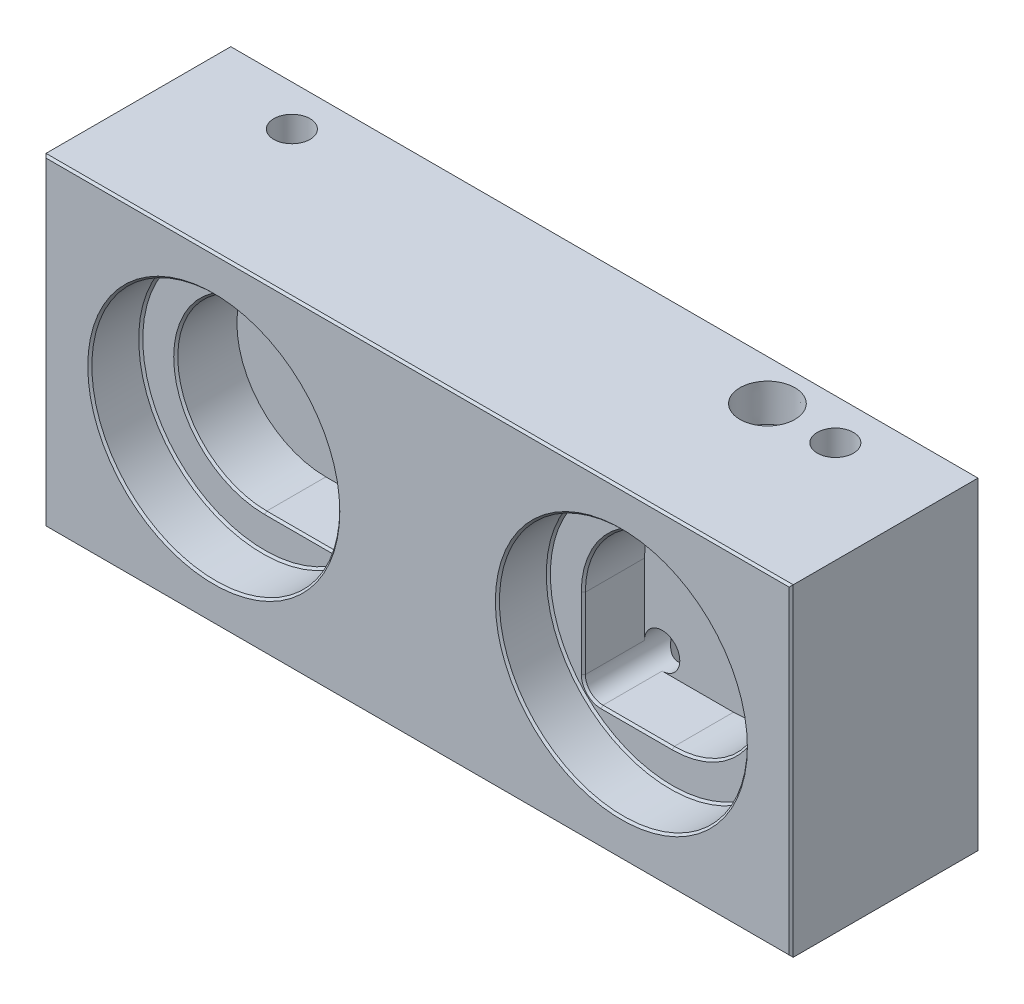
SolidWorks part; units mm, degrees
ref_plane "Front Plane" through (0, 0, 0) normal (0, 0, 1) x (1, 0, 0)
ref_plane "Top Plane" through (0, 0, 0) normal (0, 1, 0) x (1, 0, 0)
ref_plane "Right Plane" through (0, 0, 0) normal (1, 0, 0) x (0, 0, -1)
sketch "Sketch1" plane through (0, 0, 0) normal (0, 0, 1) x (1, 0, 0)
  line L1 (0, 0) -> (139.7, 0)
  line L2 (0, 0) -> (0, 60.325)
  line L3 (0, 60.325) -> (139.7, 60.325)
  line L4 (139.7, 0) -> (139.7, 60.325)
  dimension "D1" = 60.325
  dimension "D2" = 139.7
extrude "BAR STOCK" add sketch "Sketch1" along normal blind 34.925
sketch "Sketch3" plane through (0, 0, 34.925) normal (0, 0, 1) x (1, 0, 0)
  line L0 (69.85, 60.325) -> (69.85, -16.0681) construction
  line L1 (139.7, 60.325) -> (0, 60.325) construction
  line L2 (0, 30.1625) -> (211.9405, 30.1625) construction
  line L3 (0, 60.325) -> (0, 0) construction
  circle A0 centre (31.75, 30.1625) radius 23.1775
  circle A1 centre (107.95, 30.1625) radius 23.1775
  dimension "D1" = 46.355
  dimension "D3" = 46.355
  dimension "D2" = 38.1
  dimension "D4" = 38.1
extrude "pump holes" cut sketch "Sketch3" against normal blind 9.525
sketch "Sketch4" plane through (0, 0, 25.4) normal (0, 0, 1) x (1, 0, 0)
  line L0 (31.75, 13.5255) -> (45.085, 13.5255)
  line L1 (48.387, 30.1625) -> (48.387, 16.8275)
  line L2 (91.313, 30.1625) -> (91.313, 16.8275)
  line L3 (107.95, 13.5255) -> (94.615, 13.5255)
  arc A0 (48.387, 30.1625) -> (31.75, 13.5255) centre (31.75, 30.1625) ccw
  arc A1 (107.95, 13.5255) -> (91.313, 30.1625) centre (107.95, 30.1625) ccw
  arc A2 (91.313, 16.8275) -> (94.615, 13.5255) centre (94.615, 16.8275) ccw
  arc A3 (48.387, 16.8275) -> (45.085, 13.5255) centre (45.085, 16.8275) cw
  dimension "D1" = 33.274
  dimension "D2" = 33.274
  dimension "D3" = 3.302
extrude "pump volute" cut sketch "Sketch4" against normal blind 11.43
sketch "Sketch5" plane through (0, 0, 13.97) normal (0, 0, 1) x (1, 0, 0)
  circle A0 centre (31.75, 30.1625) radius 4.7625
  circle A1 centre (107.95, 30.1625) radius 4.7625
  circle A2 centre (94.615, 16.8275) radius 3.302
  circle A3 centre (45.085, 16.8275) radius 3.302
  point P11 (31.75, 30.1625)
  point P12 (107.95, 30.1625)
  dimension "D1" = 9.525
  dimension "D2" = 9.525
extrude "pump flow holes" cut sketch "Sketch5" against normal blind 6.35
sketch "Sketch6" plane through (0, 0, 0) normal (0, -1, 0) x (1, 0, 0)
  line L0 (-0.7642, 7.62) -> (112.7125, 7.62) construction
  line L2 (31.75, 7.62) -> (31.75, 25.3945) construction
  line L3 (36.5125, 7.62) -> (26.9875, 7.62) construction
  line L4 (45.085, 7.62) -> (45.085, 13.4169) construction
  line L5 (48.387, 7.62) -> (41.783, 7.62) construction
  line L6 (45.085, 13.97) -> (45.085, 25.4) construction
  circle A0 centre (31.75, 7.62) radius 3.3782
  dimension "D1" = 13.335
  dimension "D3" = 6.7564
extrude "stir inlet" cut sketch "Sketch6" against normal blind 34.925
sketch "Sketch7" plane through (0, 0, 0) normal (0, -1, 0) x (1, 0, 0)
  line L0 (31.75, 7.62) -> (121.5146, 7.62) construction
  line L1 (45.085, 7.62) -> (45.085, 9.7353) construction
  line L2 (48.387, 7.62) -> (41.783, 7.62) construction
  line L3 (94.615, 7.62) -> (94.615, 15.1152) construction
  line L4 (97.917, 7.62) -> (91.313, 7.62) construction
  circle A0 centre (45.085, 7.62) radius 3.3782
  circle A1 centre (94.615, 7.62) radius 3.3782
  dimension "D1" = 6.7564
  dimension "D2" = 6.7564
extrude "stir flush out" cut sketch "Sketch7" against normal blind 19.05
sketch "Sketch10" plane through (0, 0, 0) normal (0, -1, 0) x (1, 0, 0)
  line L0 (3.7298, 7.62) -> (135.9702, 7.62) construction
  line L1 (69.85, 0) -> (69.85, 30.8232) construction
  line L2 (0, 0) -> (139.7, 0) construction
  circle A1 centre (19.05, 7.62) radius 3.3782
  circle A2 centre (120.65, 7.62) radius 3.3782
  point P7 (0, 0)
  dimension "D1" = 6.7564
  dimension "D2" = 50.8
  dimension "D3" = 6.7564
  dimension "D4" = 50.8
extrude "mounting holes" cut sketch "Sketch10" against normal through all
sketch "Sketch11" plane through (0, 0, 34.925) normal (0, 0, 1) x (1, 0, 0)
  line L8 (0, 60.325) -> (0, 0)
  line L9 (0, 0) -> (139.7, 0)
  line L10 (139.7, 0) -> (139.7, 60.325)
  line L11 (139.7, 60.325) -> (0, 60.325)
  line L12 (0, 60.325) -> (0, 0)
  line L13 (0, 0) -> (139.7, 0)
  line L14 (139.7, 0) -> (139.7, 60.325)
  line L15 (139.7, 60.325) -> (0, 60.325)
  circle A6 centre (31.75, 30.1625) radius 25.7175
  circle A7 centre (31.75, 30.1625) radius 25.7175
  circle A9 centre (107.95, 30.1625) radius 25.7175
  circle A10 centre (107.95, 30.1625) radius 25.7175
  dimension "D1" = 2.54
  dimension "D2" = 2.54
  dimension "D3" = 0
extrude "weight relif 1" [suppressed] cut sketch "Sketch11" against normal blind 19.05
sketch "Sketch12" [suppressed] plane through (0, 0, 15.875) normal (0, 0, 1) x (1, 0, 0)
  line L0 (55.0226, 9.525) -> (84.6774, 9.525)
  line L1 (9.525, 16.3602) -> (9.525, 0)
  line L3 (69.85, 60.325) -> (69.85, 48.0842) construction
  line L4 (139.7, 60.325) -> (0, 60.325)
  line L5 (0, 60.325) -> (0, 0)
  line L6 (0, 0) -> (9.525, 0)
  line L9 (139.7, 60.325) -> (139.7, 0)
  line L10 (0, 0) -> (139.7, 0) construction
  line L11 (139.7, 0) -> (130.175, 0)
  line L12 (130.175, 16.3602) -> (130.175, 0)
  line L18 (139.7, 60.325) -> (0, 60.325) construction
  circle A0 centre (31.75, 30.1625) radius 25.7175 construction
  arc A1 (52.3745, 14.7995) -> (9.1276, 17.9307) centre (31.75, 30.1625) ccw
  circle A3 centre (107.95, 30.1625) radius 25.7175 construction
  arc A4 (130.5724, 17.9307) -> (87.3255, 14.7995) centre (107.95, 30.1625) ccw
  arc A5 (87.3255, 14.7995) -> (84.6774, 9.525) centre (84.6774, 12.827) cw
  arc A6 (55.0226, 9.525) -> (52.3745, 14.7995) centre (55.0226, 12.827) cw
  arc A8 (130.175, 16.3602) -> (130.5724, 17.9307) centre (133.477, 16.3602) cw
  arc A16 (9.1276, 17.9307) -> (9.525, 16.3602) centre (6.223, 16.3602) cw
  point P17 (47.0955, 9.525)
  point P31 (130.175, 16.0026)
  point P44 (9.525, 17.2227)
  dimension "D8" = 3.302
  dimension "D4" = 3.302
  dimension "D5" = 3.302
  dimension "D2" = 60.325
  dimension "D3" = 9.525
  dimension "D1" = 60.325
extrude "profile cut" [suppressed] cut sketch "Sketch12" against normal through all
ref_plane "Plane1" through (0, 60.325, 0) normal (0, 1, 0) x (1, 0, 0)
ref_plane "Plane3" through (0, 30.1625, 0) normal (0, 1, 0) x (1, 0, 0)
sketch "Sketch13" [suppressed] plane through (0, 0, 0) normal (0, 0, -1) x (-1, 0, 0)
  line L0 (-69.85, 0) -> (-69.85, 68.6634) construction
  line L1 (-84.6774, 9.525) -> (-85.471, 9.525)
  line L2 (-126.492, 0) -> (-126.492, 47.2214)
  line L3 (-13.97, 47.9834) -> (-38.8333, 47.9834)
  line L4 (-130.175, 16.3602) -> (-130.175, 0)
  line L5 (-130.175, 0) -> (-9.525, 0)
  line L6 (-9.525, 0) -> (-9.525, 16.3602)
  line L7 (-55.0226, 9.525) -> (-84.6774, 9.525)
  line L8 (-130.175, 16.3602) -> (-130.175, 0)
  line L9 (-88.773, 30.1625) -> (-88.773, 12.827)
  line L10 (-9.525, 0) -> (-130.175, 0) construction
  line L11 (-13.208, 0) -> (-9.525, 0)
  line L12 (-130.175, 16.3602) -> (-130.175, 0) construction
  line L13 (-125.73, 47.9834) -> (-100.8667, 47.9834)
  line L14 (-91.313, 30.1625) -> (-91.313, 16.8275) construction
  line L16 (-50.927, 30.1625) -> (-50.927, 12.827)
  line L17 (-9.525, 16.3602) -> (-9.525, 0)
  line L18 (-13.208, 0) -> (-13.208, 47.2214)
  line L19 (-55.0226, 9.525) -> (-54.229, 9.525)
  line L22 (-126.492, 0) -> (-130.175, 0)
  line L29 (-120.65, 2.9091) -> (-120.65, 55.6274) construction
  arc A0 (-88.773, 30.1625) -> (-100.8667, 47.9834) centre (-107.95, 30.1625) ccw
  arc A1 (-126.492, 47.9834) -> (-130.5724, 17.9307) centre (-107.95, 30.1625) ccw
  arc A2 (-85.471, 9.525) -> (-88.773, 12.827) centre (-85.471, 12.827) cw
  arc A3 (-125.73, 47.9834) -> (-126.492, 47.2214) centre (-125.73, 47.2214) ccw
  arc A5 (-9.525, 16.3602) -> (-9.1276, 17.9307) centre (-6.223, 16.3602) cw
  arc A6 (-9.1276, 17.9307) -> (-9.525, 16.3602) centre (-6.223, 16.3602) ccw
  arc A7 (-9.1276, 17.9307) -> (-52.3745, 14.7995) centre (-31.75, 30.1625) ccw
  arc A8 (-55.0226, 9.525) -> (-52.3745, 14.7995) centre (-55.0226, 12.827) ccw
  arc A9 (-87.3255, 14.7995) -> (-84.6774, 9.525) centre (-84.6774, 12.827) ccw
  arc A10 (-87.3255, 14.7995) -> (-130.5724, 17.9307) centre (-107.95, 30.1625) ccw
  arc A11 (-130.175, 16.3602) -> (-130.5724, 17.9307) centre (-133.477, 16.3602) ccw
  arc A12 (-52.3745, 14.7995) -> (-13.208, 47.9834) centre (-31.75, 30.1625) cw
  arc A13 (-52.3745, 14.7995) -> (-55.0226, 9.525) centre (-55.0226, 12.827) cw
  arc A15 (-87.3255, 14.7995) -> (-84.6774, 9.525) centre (-84.6774, 12.827) ccw
  arc A16 (-87.3255, 14.7995) -> (-126.492, 47.9834) centre (-107.95, 30.1625) ccw
  arc A17 (-130.175, 16.3602) -> (-130.5724, 17.9307) centre (-133.477, 16.3602) ccw
  arc A18 (-13.97, 47.9834) -> (-13.208, 47.2214) centre (-13.97, 47.2214) cw
  arc A19 (-54.229, 9.525) -> (-50.927, 12.827) centre (-54.229, 12.827) ccw
  arc A20 (-13.208, 47.9834) -> (-9.1276, 17.9307) centre (-31.75, 30.1625) cw
  arc A21 (-50.927, 30.1625) -> (-38.8333, 47.9834) centre (-31.75, 30.1625) cw
  dimension "D5" = 3.302
  dimension "D6" = 9.525
  dimension "D7" = 0.762
  dimension "D3" = 5.842
  dimension "D4" = 2.54
  dimension "D1" = 0
extrude "rear cut 1" [suppressed] cut sketch "Sketch13" against normal blind 22.86
sketch "Sketch14" plane through (0, 60.325, 0) normal (0, 1, 0) x (1, 0, 0)
  line L0 (107.95, -7.62) -> (107.95, 3.6647) construction
  line L1 (103.1875, -7.62) -> (112.7125, -7.62) construction
  circle A0 centre (107.95, -7.62) radius 3.81
  dimension "D1" = 7.62
extrude "flush inlet" cut sketch "Sketch14" against normal blind 22.86
sketch "Sketch15" plane through (0, 0, 0) normal (0, -1, 0) x (1, 0, 0)
  line L0 (47.5271, 7.62) -> (42.6429, 7.62) construction
  line L1 (97.0571, 7.62) -> (92.1729, 7.62) construction
  circle A0 centre (31.75, 7.62) radius 3.9751
  circle A1 centre (45.085, 7.62) radius 3.9751
  circle A2 centre (94.615, 7.62) radius 3.9751
  dimension "D1" = 7.9502
  dimension "D2" = 7.9502
  dimension "D3" = 7.9502
extrude "port tube c bores" cut sketch "Sketch15" against normal blind 9.525
sketch "Sketch16" plane through (0, 0, 0) normal (0, -1, 0) x (1, 0, 0)
  line L0 (97.0571, 7.62) -> (92.1729, 7.62) construction
  circle A0 centre (31.75, 7.62) radius 6.0071
  circle A1 centre (45.085, 7.62) radius 6.0071
  circle A2 centre (94.615, 7.62) radius 6.0071
  dimension "D1" = 12.0142
  dimension "D2" = 12.0142
  dimension "D3" = 12.0142
extrude "orings bores" cut sketch "Sketch16" against normal blind 1.3716
chamfer "Chamfer1" distance 0.381 angle 45 16 edges at (131.1275, 30.1625, 25.4) (101.2825, 13.5255, 25.4) (119.7141, 41.9266, 25.4) (91.313, 23.495, 25.4) (92.2801, 14.4926, 25.4) (131.1275, 30.1625, 34.925) (54.9275, 30.1625, 25.4) (38.4175, 13.5255, 25.4) (47.4199, 14.4926, 25.4) (48.387, 23.495, 25.4) (19.9859, 41.9266, 25.4) (54.9275, 30.1625, 34.925) (69.85, 60.325, 34.925) (139.7, 30.1625, 34.925) (69.85, 0, 34.925) (0, 30.1625, 34.925)
hole_wizard "1/8 NPT Tapped Hole1" positions "Sketch18" profile "Sketch17" size "1/8" standard "ANSI Inch"
sketch "Sketch18" plane through (0, 60.325, 0) normal (0, 1, 0) x (1, 0, 0)
  point P0 (107.95, -7.62)
sketch "Sketch17" plane through (107.95, 60.325, 7.62) normal (1, 0, 0) x (0, 0, 1)
  line L0 (0, 0) -> (0, 32.695)
  line L1 (4.2164, 30.1615) -> (0, 32.695)
  line L2 (-4.2164, 30.1615) -> (0, 32.695) construction
  line L3 (4.2164, 30.1615) -> (4.2164, 6.858)
  line L4 (4.2164, 6.858) -> (4.9362, 6.858)
  line L5 (4.9362, 6.858) -> (5.1415, 0)
  line L6 (-4.9362, 6.858) -> (-5.1415, 0) construction
  line L7 (5.1415, 0) -> (0, 0)
  line L8 (0, -6.35) -> (0, 107.95) construction
  line L11 (-4.2164, 6.858) -> (-4.9362, 6.858) construction
  dimension "Tap Drill Dia." = 8.4328
  dimension "Tap Drill Depth" = 30.1615
  dimension "Thread Dia." = 10.283
  dimension "Thread Angle" = 3.43
  dimension "Thread Depth" = 6.858
  dimension "Drill Angle" = 118
ref_plane "Plane2" [suppressed] through (69.85, 0, 0) normal (-1, 0, 0) x (0, 0, 1)
